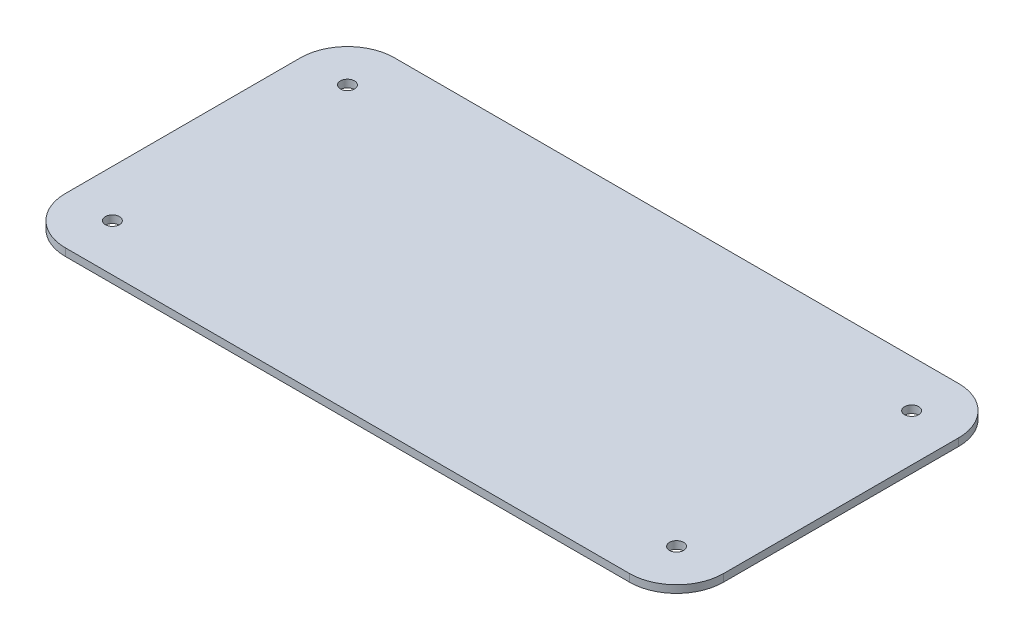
SolidWorks part; units mm, degrees
ref_plane "Plan1" through (0, 0, 0) normal (0, 0, 1) x (1, 0, 0)
ref_plane "Plan2" through (0, 0, 0) normal (0, 1, 0) x (1, 0, 0)
ref_plane "Plan3" through (0, 0, 0) normal (1, 0, 0) x (0, 0, -1)
sketch "Esquisse1" plane through (0, 0, 0) normal (0, 1, 0) x (1, 0, 0)
  line L1 (50, 0) -> (650, 0)
  line L2 (0, 50) -> (0, 300)
  line L3 (50, 350) -> (650, 350)
  line L4 (700, 50) -> (700, 300)
  arc A0 (0, 50) -> (50, 0) centre (50, 50) ccw
  arc A1 (50, 350) -> (0, 300) centre (50, 300) ccw
  arc A2 (700, 300) -> (650, 350) centre (650, 300) ccw
  arc A3 (650, 0) -> (700, 50) centre (650, 50) ccw
  point P7 (0, 0)
  dimension "D1" = 50
extrude "Base-Extrusion" add sketch "Esquisse1" along normal blind 8
sketch "Esquisse2" plane through (0, 8, 0) normal (0, 1, 0) x (-1, 0, 0)
  circle A0 centre (-50, -50) radius 7.5
  circle A1 centre (-50, -300) radius 7.5
  circle A2 centre (-650, -50) radius 7.5
  circle A3 centre (-650, -300) radius 7.5
extrude "Enlèv. mat.-Extru.1" cut sketch "Esquisse2" against normal blind 8
